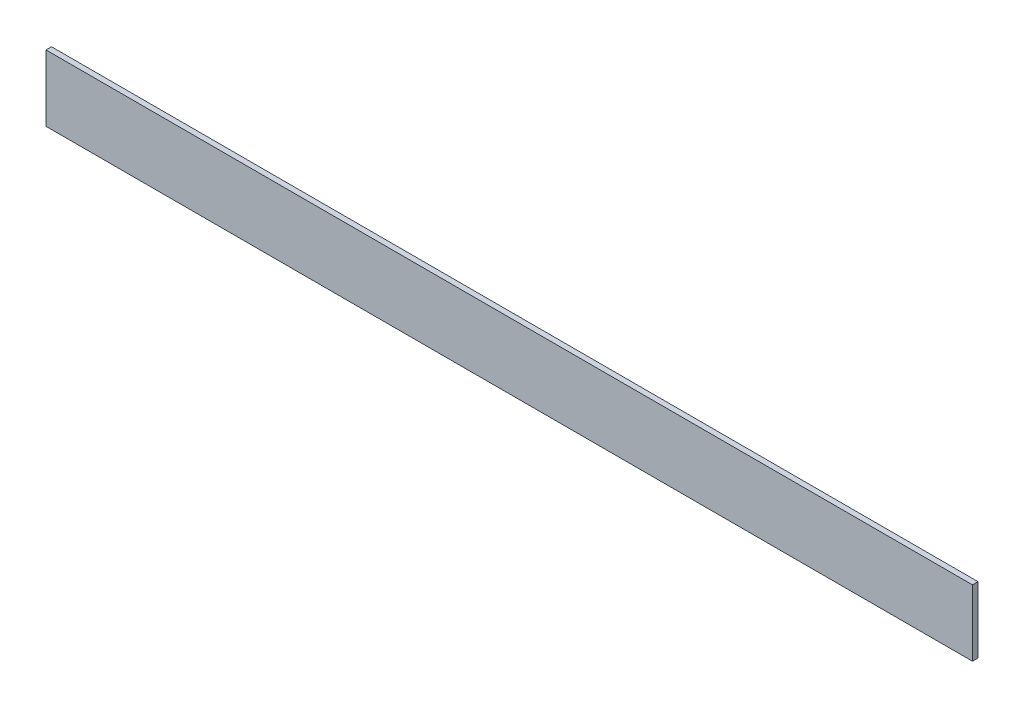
SolidWorks part; units mm, degrees
ref_plane "Front Plane" through (0, 0, 0) normal (0, 0, 1) x (1, 0, 0)
ref_plane "Top Plane" through (0, 0, 0) normal (0, 1, 0) x (1, 0, 0)
ref_plane "Right Plane" through (0, 0, 0) normal (1, 0, 0) x (0, 0, -1)
sketch "Sketch1" plane through (0, 0, 0) normal (0, 0, 1) x (1, 0, 0)
  line L1 (-533.4, -38.1) -> (533.4, -38.1)
  line L2 (-533.4, -38.1) -> (-533.4, 38.1)
  line L3 (-533.4, 38.1) -> (533.4, 38.1)
  line L4 (533.4, -38.1) -> (533.4, 38.1)
  line L5 (-533.4, -38.1) -> (533.4, 38.1) construction
  line L6 (-533.4, 38.1) -> (533.4, -38.1) construction
  point P0 (0, 0)
  dimension "D1" = 76.2
  dimension "D2" = 1066.8
extrude "Boss-Extrude1" add sketch "Sketch1" along normal blind 6.35
